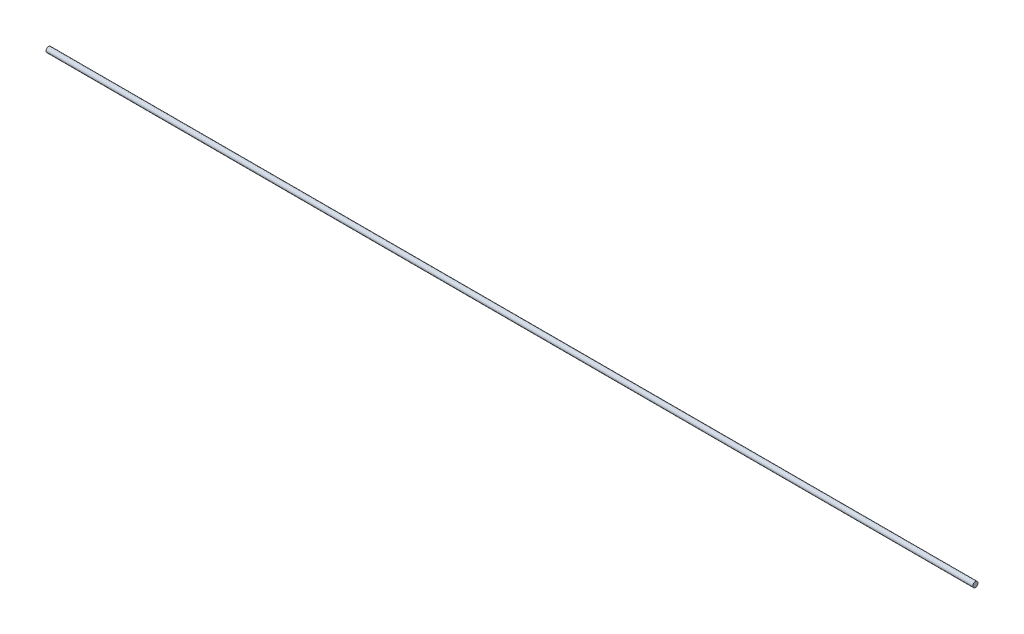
SolidWorks part; units mm, degrees
ref_plane "Front Plane" through (0, 0, 0) normal (0, 0, 1) x (1, 0, 0)
ref_plane "Top Plane" through (0, 0, 0) normal (0, 1, 0) x (1, 0, 0)
ref_plane "Right Plane" through (0, 0, 0) normal (1, 0, 0) x (0, 0, -1)
sketch "Sketch1" plane through (0, 0, 0) normal (1, 0, 0) x (0, 0, -1)
  circle A0 centre (0, 0) radius 3
  dimension "D1" = 6
extrude "Boss-Extrude1" add sketch "Sketch1" along normal blind 1076
